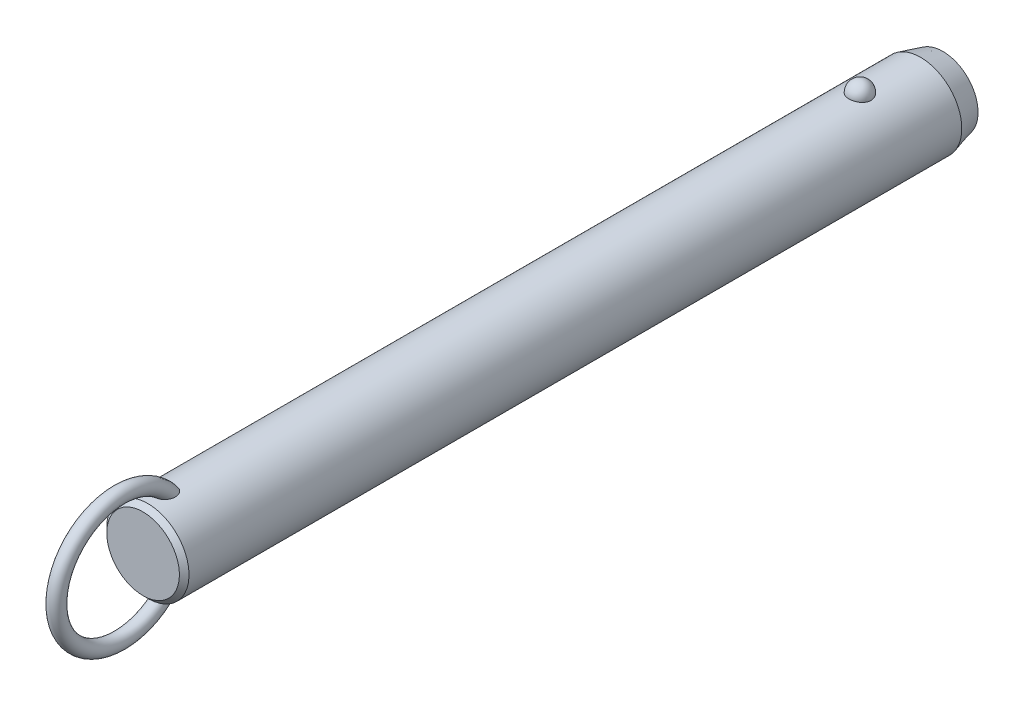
SolidWorks part; units mm, degrees
ref_plane "Front Plane" through (0, 0, 0) normal (0, 0, 1) x (1, 0, 0)
ref_plane "Top Plane" through (0, 0, 0) normal (0, 1, 0) x (1, 0, 0)
ref_plane "Right Plane" through (0, 0, 0) normal (1, 0, 0) x (0, 0, -1)
sketch "Sketch2" plane through (0, 0, 0) normal (0, 0, 1) x (1, 0, 0)
  circle A0 centre (0, 0) radius 11.1
  point P3 (0, 11.1)
  dimension "D1" = 22.2
extrude "Boss-Extrude1" add sketch "Sketch2" along normal blind 177.8
sketch "Sketch3" plane through (0, 0, 0) normal (0, 0, -1) x (-1, 0, 0)
  circle A0 centre (0, 0) radius 11.1
  dimension "D1" = 22.2
extrude "Boss-Extrude2" add sketch "Sketch3" along normal blind 25.4
chamfer "Chamfer1" distance 6 angle 15 1 edges at (-11.1, 0, -25.4)
sketch "Sketch12" plane through (0, 0, 0) normal (1, 0, 0) x (0, 0, -1)
  line L0 (-177.8, 11.1) -> (-177.8, -11.1) construction
  point P0 (-177.8, 0)
sketch "Sketch13" plane through (0, 0, 0) normal (1, 0, 0) x (0, 0, -1)
  circle A0 centre (-196.85, 0) radius 19.05
  point P2 (-177.8, 0)
  dimension "D1" = 38.1
sketch "Sketch14" plane through (0, 0, 0) normal (0, 1, 0) x (1, 0, 0)
  circle A0 centre (0, -179.8) radius 2
  point P2 (0, -177.8)
  dimension "D1" = 4
sweep "Sweep1" add profiles "Sketch14" path "Sketch13"
sketch "Sketch15" plane through (0, 0, 177.8) normal (0, 0, 1) x (1, 0, 0)
  circle A0 centre (0, 0) radius 11.1
  dimension "D1" = 22.2
extrude "Boss-Extrude3" add sketch "Sketch15" along normal blind 12.7
chamfer "Chamfer2" distance 1.3 angle 45 1 edges at (11.1, 0, 190.5)
sketch "Sketch18" plane through (0, 0, 0) normal (1, 0, 0) x (0, 0, -1)
  line L0 (19.4, 11.1) -> (-181.368, 11.1) construction
  line L1 (3, 14.1) -> (3, 8.1)
  line L2 (-181.368, -11.1) -> (19.4, -11.1) construction
  arc A0 (3, 14.1) -> (3, 8.1) centre (3, 11.1) ccw
  point P4 (0, 11.1)
  dimension "D1" = 25.2
revolve "Revolve1" add sketch "Sketch18" angle 360 about L1
